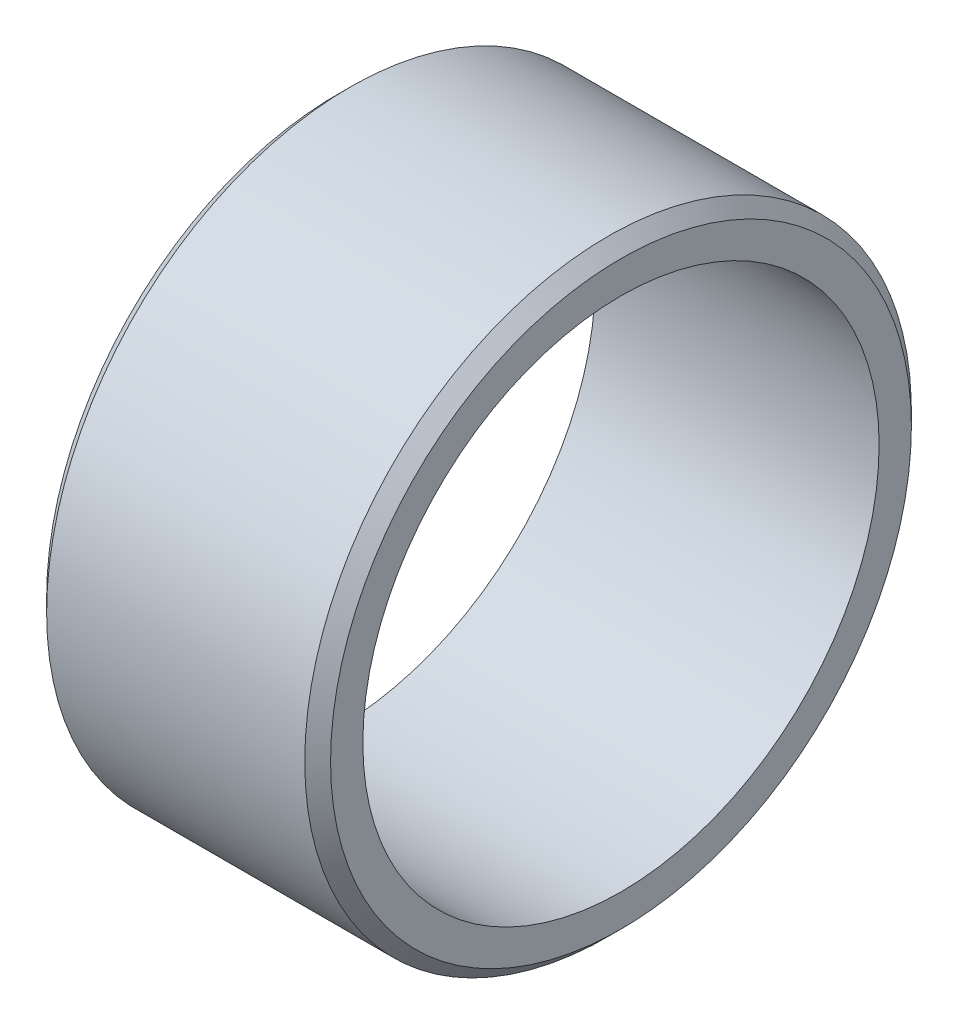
SolidWorks part; units mm, degrees
ref_plane "Plan de face" through (0, 0, 0) normal (0, 0, 1) x (1, 0, 0)
ref_plane "Plan de dessus" through (0, 0, 0) normal (0, 1, 0) x (1, 0, 0)
ref_plane "Plan de droite" through (0, 0, 0) normal (1, 0, 0) x (0, 0, -1)
sketch "Esquisse1" plane through (0, 0, 0) normal (0, 0, 1) x (1, 0, 0)
  line L0 (-20.6639, 0) -> (23.215, 0) construction
  line L1 (-1, 23.5) -> (0, 22.5)
  line L2 (-21, 23.5) -> (-1, 23.5)
  line L3 (-22, 22.5) -> (-22, 20)
  line L4 (-22, 20) -> (0, 20)
  line L5 (0, 22.5) -> (0, 20)
  line L6 (-22, 22.5) -> (-21, 23.5)
  point P3 (-22, 23.5)
  point P6 (0, 23.5)
  dimension "D1" = 40
  dimension "D2" = 47
  dimension "D3" = 22
  dimension "D4" = 1
  dimension "D5" = 45
  dimension "D6" = 1
  dimension "D7" = 45
revolve "Révolution1" add sketch "Esquisse1" angle 360 about L0
